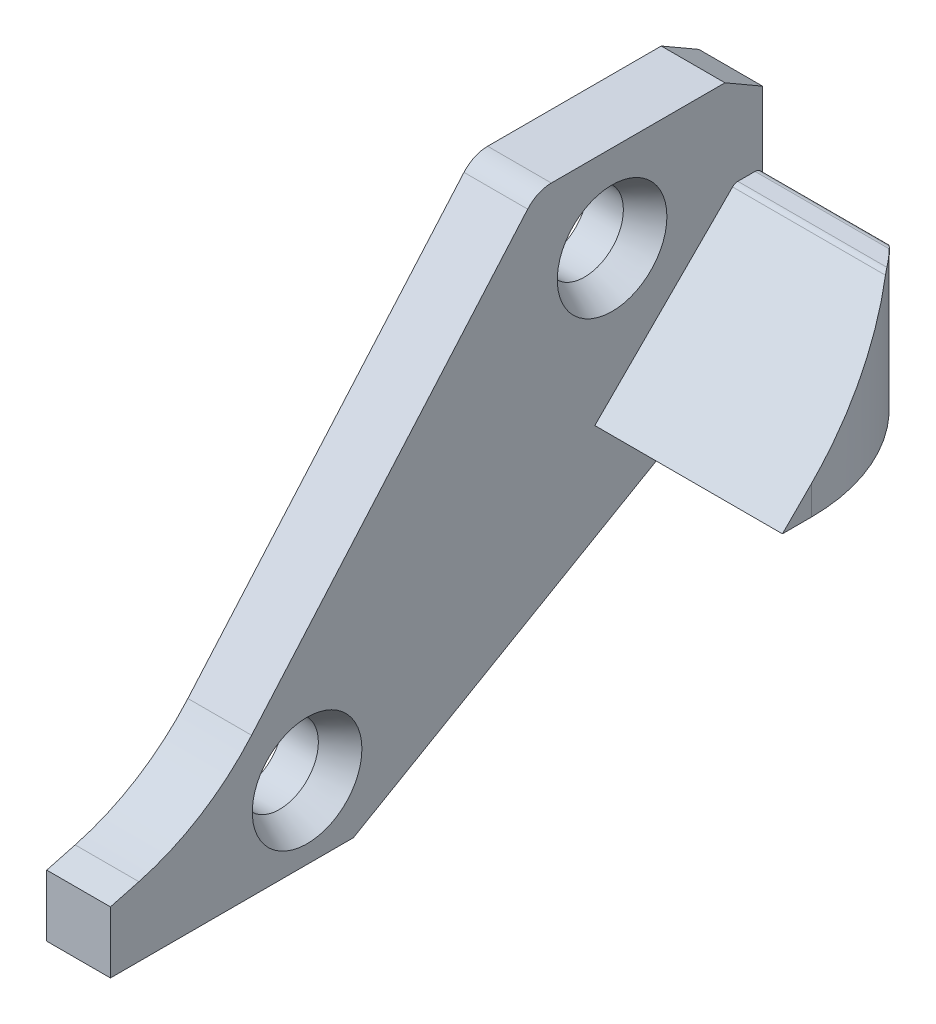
SolidWorks part; units mm, degrees
ref_plane "Спереди" through (0, 0, 0) normal (0, 0, 1) x (1, 0, 0)
ref_plane "Сверху" through (0, 0, 0) normal (0, 1, 0) x (1, 0, 0)
ref_plane "Справа" through (0, 0, 0) normal (1, 0, 0) x (0, 0, -1)
sketch "Эскиз1" plane through (0, 0, 0) normal (1, 0, 0) x (0, 0, -1)
  line L0 (-25.4, -19.304) -> (-25.4, -16.1852)
  line L1 (-25.4, -16.1852) -> (-23.9607, -15.7996)
  line L2 (-18.2533, -12.2332) -> (-4.2739, 3.8482)
  line L3 (-3.0758, 4.3942) -> (5.715, 4.3942)
  line L4 (5.715, 4.3942) -> (7.62, 3.2943)
  line L5 (7.62, 3.2943) -> (7.62, -7.3406)
  line L6 (7.62, -7.3406) -> (-13.1012, -19.304)
  line L7 (-13.1012, -19.304) -> (-25.4, -19.304)
  circle A0 centre (0, 0) radius 1.9685
  circle A1 centre (-15.4432, -15.621) radius 1.9685
  arc A2 (-23.9607, -15.7996) -> (-18.2533, -12.2332) centre (-26.9395, -4.6824) ccw
  arc A3 (-4.2739, 3.8482) -> (-3.0758, 4.3942) centre (-3.0758, 2.8067) cw
  dimension "D1" = 3.937
  dimension "D13" = 11.5094
  dimension "D17" = 1.5875
  dimension "D2" = 15.4432
  dimension "D3" = 15.621
  dimension "D4" = 41
  dimension "D5" = 30
  dimension "D6" = 1.905
  dimension "D7" = 7.62
  dimension "D8" = 4.3942
  dimension "D9" = 7.3406
  dimension "D10" = 2.032
  dimension "D11" = 19.304
  dimension "D12" = 25.4
  dimension "D14" = 30
  dimension "D15" = 4.3434
  dimension "D16" = 15
extrude "Бобышка-Вытянуть1" add sketch "Эскиз1" along normal blind 3.2258
sketch "Эскиз2" plane through (3.2258, 0, 0) normal (1, 0, 0) x (0, 0, -1)
  line L0 (7.62, -7.3406) -> (7.62, -0.635)
  line L1 (7.62, -7.3406) -> (7.62, 3.2943) construction
  line L2 (7.239, -0.254) -> (6.3696, -0.254)
  line L3 (6.1002, -0.3656) -> (-0.8748, -7.3406)
  line L4 (-0.8748, -7.3406) -> (7.62, -7.3406)
  arc A0 (7.62, -0.635) -> (7.239, -0.254) centre (7.239, -0.635) ccw
  arc A1 (6.3696, -0.254) -> (6.1002, -0.3656) centre (6.3696, -0.635) ccw
  point P10 (7.62, -0.254)
  dimension "D4" = 0.381
  dimension "D1" = 45
  dimension "D2" = 0.254
  dimension "D3" = 4.572
extrude "Бобышка-Вытянуть2" add sketch "Эскиз2" along normal offset from surface (9.4996 mm away) 12.7254
sketch "Эскиз3" plane through (0, -0.254, 0) normal (0, 1, 0) x (1, 0, 0)
  line L0 (12.7254, 0.5894) -> (12.7254, 7.62)
  line L1 (12.7254, 7.62) -> (9.6266, 7.62)
  line L2 (12.7254, -0.8748) -> (12.7254, 7.62) construction
  line L3 (12.7254, 7.62) -> (3.2258, 7.62) construction
  line L4 (0, 5.715) -> (0, -3.0758) construction
  arc A0 (9.6266, 7.62) -> (12.7254, 0.5894) centre (3.2004, 0.5894) cw
  dimension "D1" = 9.525
  dimension "D2" = 9.6266
extrude "Вырез-Вытянуть1" cut sketch "Эскиз3" against normal up to surface (7.0866 mm away)
chamfer "Фаска1" distance 1.397 angle 30 2 edges at (3.2258, -15.621, 13.4747) (3.2258, 0, -1.9685)
